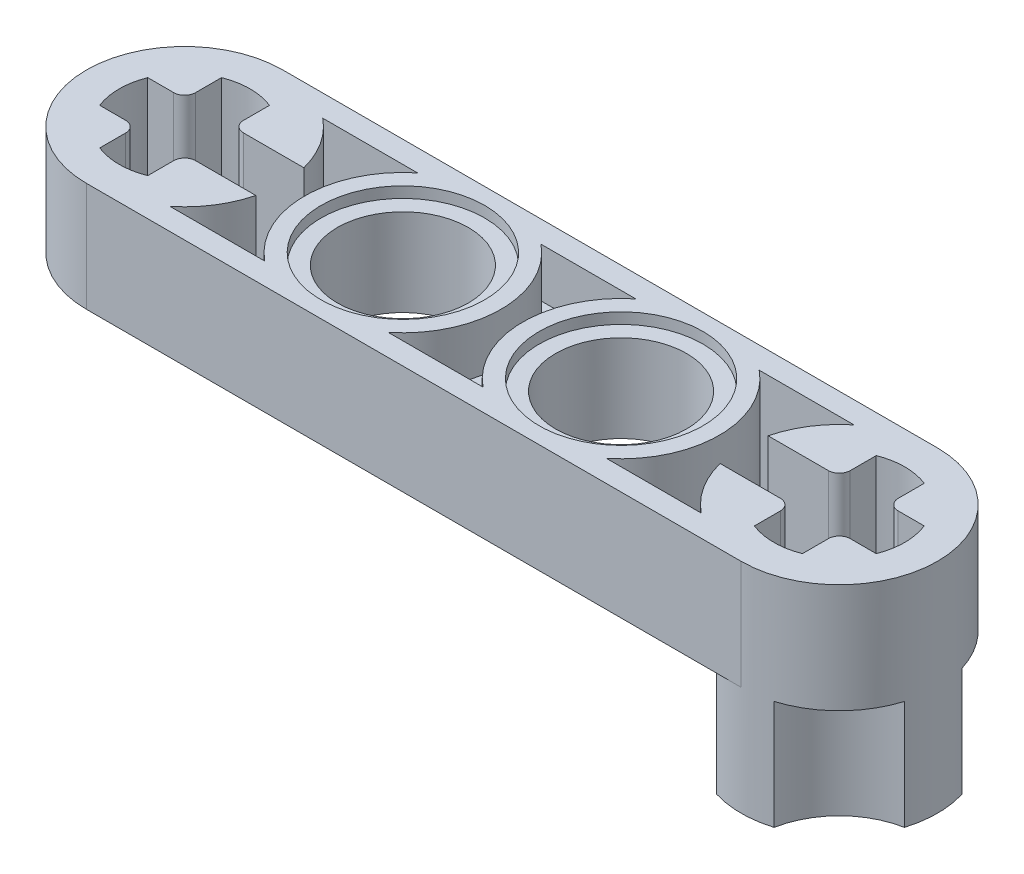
SolidWorks part; units mm, degrees
ref_plane "Front Plane" through (0, 0, 0) normal (0, 0, 1) x (1, 0, 0)
ref_plane "Top Plane" through (0, 0, 0) normal (0, 1, 0) x (1, 0, 0)
ref_plane "Right Plane" through (0, 0, 0) normal (1, 0, 0) x (0, 0, -1)
sketch "Sketch1" plane through (0, 0, 0) normal (0, 1, 0) x (1, 0, 0)
  line L0 (-12, 3.6) -> (12, 3.6)
  line L1 (12, -3.6) -> (-12, -3.6)
  line L2 (-14.2328, 0.88) -> (-13.28, 0.88)
  line L3 (-14.2328, -0.88) -> (-13.28, -0.88)
  line L4 (-11.12, 2.2328) -> (-11.12, 1.28)
  line L5 (-12.88, -2.2328) -> (-12.88, -1.28)
  line L6 (11.12, 2.2328) -> (11.12, 1.28)
  line L7 (12.88, -2.2328) -> (12.88, -1.28)
  line L8 (14.2328, 0.88) -> (13.28, 0.88)
  line L9 (-10.72, 0.88) -> (-9.7672, 0.88)
  line L10 (9.7672, -0.88) -> (10.72, -0.88)
  line L11 (-12.88, 1.28) -> (-12.88, 2.2328)
  line L12 (-10.72, -0.88) -> (-9.7672, -0.88)
  line L13 (-11.12, -1.28) -> (-11.12, -2.2328)
  line L14 (10.72, 0.88) -> (9.7672, 0.88)
  line L15 (13.28, -0.88) -> (14.2328, -0.88)
  line L16 (11.12, -1.28) -> (11.12, -2.2328)
  line L17 (12.88, 1.28) -> (12.88, 2.2328)
  line L18 (-9.7373, 2.8) -> (-6.2627, 2.8)
  line L19 (-9.7373, -2.8) -> (-6.2627, -2.8)
  line L22 (6.2627, 2.8) -> (9.7373, 2.8)
  line L23 (6.2627, -2.8) -> (9.7373, -2.8)
  line L24 (-9.7672, 0.88) -> (-8.5092, 0.88)
  line L25 (-9.7672, -0.88) -> (-8.5092, -0.88)
  line L26 (9.7672, 0.88) -> (8.5092, 0.88)
  line L27 (9.7672, -0.88) -> (8.5092, -0.88)
  circle A0 centre (-4, 0) radius 2.4
  circle A1 centre (4, 0) radius 2.4
  arc A3 (-12.88, -2.2328) -> (-11.12, -2.2328) centre (-12, 0) ccw
  arc A7 (-11.12, 2.2328) -> (-12.88, 2.2328) centre (-12, 0) ccw
  arc A8 (-14.2328, 0.88) -> (-14.2328, -0.88) centre (-12, 0) ccw
  arc A9 (11.12, -2.2328) -> (12.88, -2.2328) centre (12, 0) ccw
  arc A10 (14.2328, -0.88) -> (14.2328, 0.88) centre (12, 0) ccw
  arc A11 (12.88, 2.2328) -> (11.12, 2.2328) centre (12, 0) ccw
  arc A12 (13.28, 0.88) -> (12.88, 1.28) centre (13.28, 1.28) cw
  arc A13 (13.28, -0.88) -> (12.88, -1.28) centre (13.28, -1.28) ccw
  arc A14 (10.72, -0.88) -> (11.12, -1.28) centre (10.72, -1.28) cw
  arc A15 (10.72, 0.88) -> (11.12, 1.28) centre (10.72, 1.28) ccw
  arc A16 (-10.72, 0.88) -> (-11.12, 1.28) centre (-10.72, 1.28) cw
  arc A17 (-10.72, -0.88) -> (-11.12, -1.28) centre (-10.72, -1.28) ccw
  arc A18 (-12.88, -1.28) -> (-13.28, -0.88) centre (-13.28, -1.28) ccw
  arc A19 (-13.28, 0.88) -> (-12.88, 1.28) centre (-13.28, 1.28) ccw
  arc A22 (-12, 3.6) -> (-12, -3.6) centre (-12, 0) ccw
  arc A23 (9.7373, 2.8) -> (8.5092, 0.88) centre (12, 0) ccw
  arc A24 (-9.7373, -2.8) -> (-8.5092, -0.88) centre (-12, 0) ccw
  arc A25 (-6.2627, 2.8) -> (-6.2627, -2.8) centre (-4, 0) ccw
  arc A26 (6.2627, -2.8) -> (6.2627, 2.8) centre (4, 0) ccw
  arc A27 (12, -3.6) -> (12, 3.6) centre (12, 0) ccw
  arc A28 (8.5092, -0.88) -> (9.7373, -2.8) centre (12, 0) ccw
  arc A29 (-8.5092, 0.88) -> (-9.7373, 2.8) centre (-12, 0) ccw
  point P39 (12.88, 0.88)
  point P44 (11.12, -0.88)
  point P51 (-11.12, -0.88)
  point P56 (-12.88, 0.88)
  dimension "D1" = 4
  dimension "D2" = 4.8
  dimension "D3" = 4
  dimension "D4" = 8
  dimension "D15" = 0.4
  dimension "D6" = 3.6
  dimension "D7" = 3.6
  dimension "D8" = 0.88
  dimension "D9" = 1.76
  dimension "D10" = 0.88
  dimension "D11" = 1.76
  dimension "D12" = 1.76
  dimension "D13" = 0.88
  dimension "D14" = 1.76
  dimension "D16" = 0.8
  dimension "D17" = 0.8
extrude "Boss-Extrude1" add sketch "Sketch1" along normal blind 4
sketch "Sketch2" plane through (0, 4, 0) normal (0, 1, 0) x (1, 0, 0)
  line L0 (-1.7373, 2.8) -> (1.7373, 2.8)
  line L1 (-1.7373, -2.8) -> (1.7373, -2.8)
  line L2 (12, 3.6) -> (-12, 3.6) construction
  line L3 (-12, -3.6) -> (12, -3.6) construction
  arc A0 (-1.7373, -2.8) -> (-1.7373, 2.8) centre (-4, 0) ccw
  arc A1 (1.7373, 2.8) -> (1.7373, -2.8) centre (4, 0) ccw
  dimension "D1" = 0.8
  dimension "D2" = 0.8
extrude "Cut-Extrude1" cut sketch "Sketch2" against normal blind 1.8
ref_plane "Plane1" through (0, 2, 0) normal (0, -1, 0) x (-1, 0, 0)
mirror "Mirror1" about plane through (0, 2, 0) normal (0, -1, 0) of "Cut-Extrude1"
sketch "Sketch3" plane through (0, 0, 0) normal (0, -1, 0) x (1, 0, 0)
  circle A0 centre (-4, 0) radius 3
  circle A1 centre (4, 0) radius 3
extrude "Cut-Extrude2" cut sketch "Sketch3" against normal blind 0.4
mirror "Mirror2" about plane through (0, 2, 0) normal (0, -1, 0) of "Cut-Extrude2"
sketch "Sketch4" plane through (0, 0, 0) normal (0, -1, 0) x (1, 0, 0)
  line L5 (10.1213, -1.8787) -> (13.8787, 1.8787) construction
  line L6 (10.1213, 1.8787) -> (13.8787, -1.8787) construction
  arc A0 (13.0522, 3.4428) -> (10.9478, 3.4428) centre (12, 0) ccw
  arc A1 (13.0522, 3.4428) -> (15.4428, 1.0522) centre (16, 4) ccw
  circle A2 centre (12, 0) radius 2.4
  arc A3 (8.5572, 1.0522) -> (10.9478, 3.4428) centre (8, 4) ccw
  arc A4 (10.9478, -3.4428) -> (8.5572, -1.0522) centre (8, -4) ccw
  arc A5 (15.4428, -1.0522) -> (13.0522, -3.4428) centre (16, -4) ccw
  arc A6 (8.5572, 1.0522) -> (8.5572, -1.0522) centre (12, 0) ccw
  arc A7 (10.9478, -3.4428) -> (13.0522, -3.4428) centre (12, 0) ccw
  arc A8 (15.4428, -1.0522) -> (15.4428, 1.0522) centre (12, 0) ccw
  dimension "D1" = 8
  dimension "D2" = 8
extrude "Boss-Extrude2" add sketch "Sketch4" along normal blind 4
